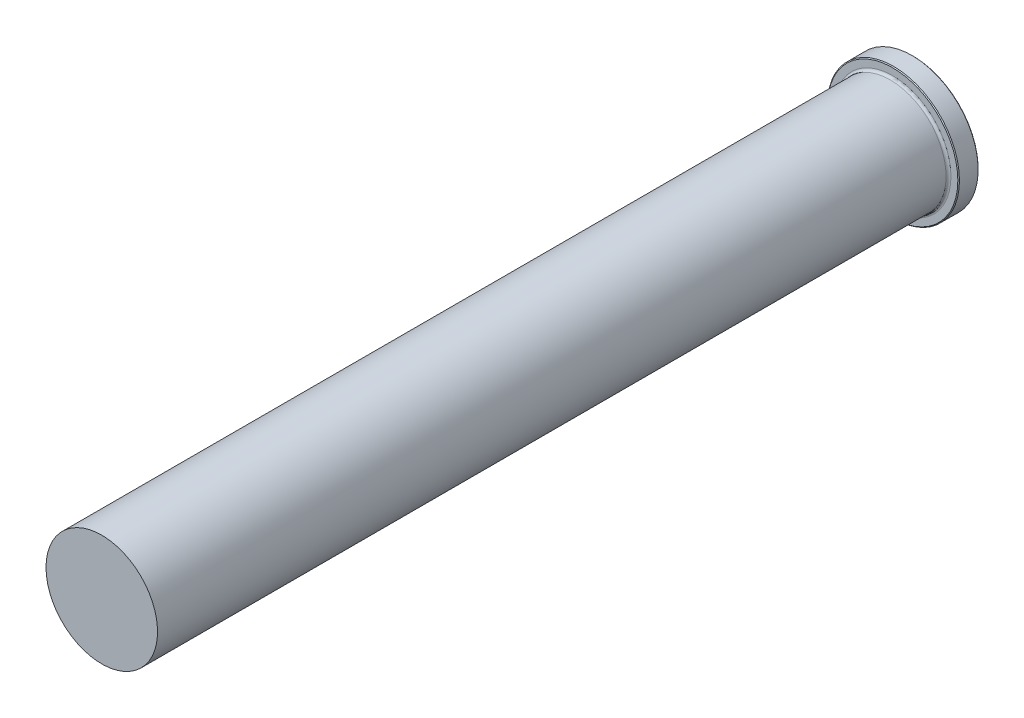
SolidWorks part; units mm, degrees
ref_plane "Front Plane" through (0, 0, 0) normal (0, 0, 1) x (1, 0, 0)
ref_plane "Top Plane" through (0, 0, 0) normal (0, 1, 0) x (1, 0, 0)
ref_plane "Right Plane" through (0, 0, 0) normal (1, 0, 0) x (0, 0, -1)
sketch "Sketch1" plane through (0, 0, 0) normal (1, 0, 0) x (0, 0, -1)
  line L0 (0, 0) -> (-156.8087, 0) construction
  line L1 (0, 0) -> (0, 20.6375)
  line L2 (0, 20.6375) -> (-6.35, 20.6375)
  line L3 (-6.35, 20.6375) -> (-6.35, 17.4625)
  line L4 (-6.35, 17.4625) -> (-254, 17.4625)
  line L5 (-254, 17.4625) -> (-254, 0)
  line L6 (-254, 0) -> (0, 0)
  dimension "D1" = 41.275
  dimension "D2" = 34.925
  dimension "D3" = 6.35
  dimension "D4" = 254
revolve "Revolve1" add sketch "Sketch1" angle 360 about L0
fillet "Fillet1" radius 0.762 1 edges at (-17.4625, 0, 6.35)
chamfer "Chamfer1" distance 0.254 angle 45 2 edges at (-20.6375, 0, 0) (-20.6375, 0, 6.35)
